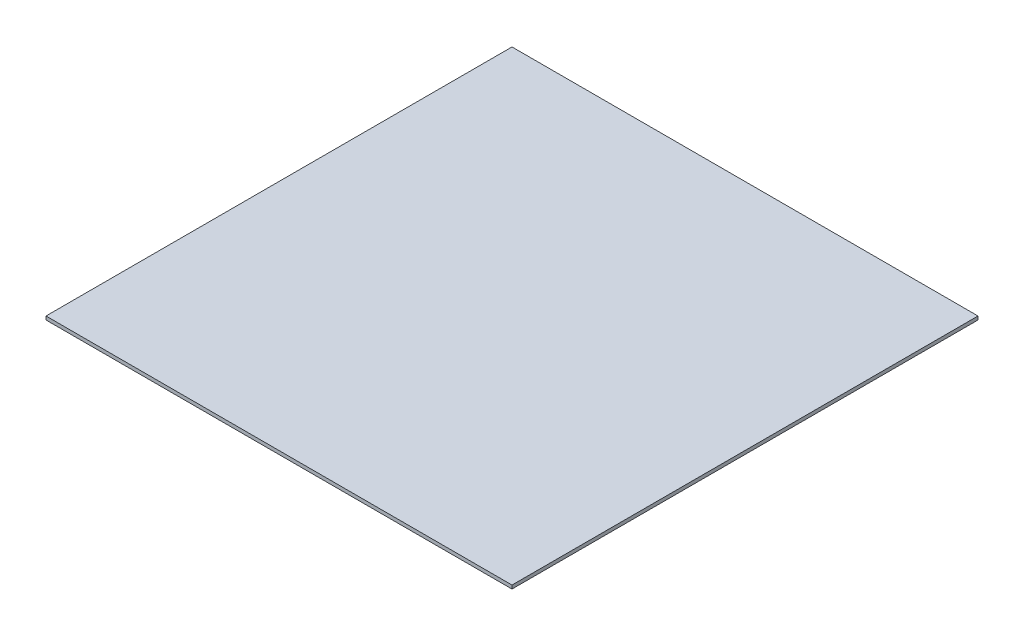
SolidWorks part; units mm, degrees
other "Objet de détail1"
ref_plane "Plan de face" through (0, 0, 0) normal (0, 0, 1) x (1, 0, 0)
ref_plane "Plan de dessus" through (0, 0, 0) normal (0, 1, 0) x (1, 0, 0)
ref_plane "Plan de droite" through (0, 0, 0) normal (1, 0, 0) x (0, 0, -1)
sketch "Esquisse1" plane through (0, 0, 0) normal (0, 1, 0) x (1, 0, 0)
  line L1 (0, 0) -> (400, 0)
  line L2 (0, 0) -> (0, 400)
  line L3 (0, 400) -> (400, 400)
  line L4 (400, 0) -> (400, 400)
  dimension "D1" = 400
  dimension "D2" = 400
extrude "Boss.-Extru.1" add sketch "Esquisse1" along normal blind 3
sketch "Esquisse2" plane through (0, 3, 0) normal (0, 1, 0) x (1, 0, 0)
  text T0 "      LA REPARABILITE  DES OBJETS TECHNIQUES" font "Century Gothic" height in points 80
